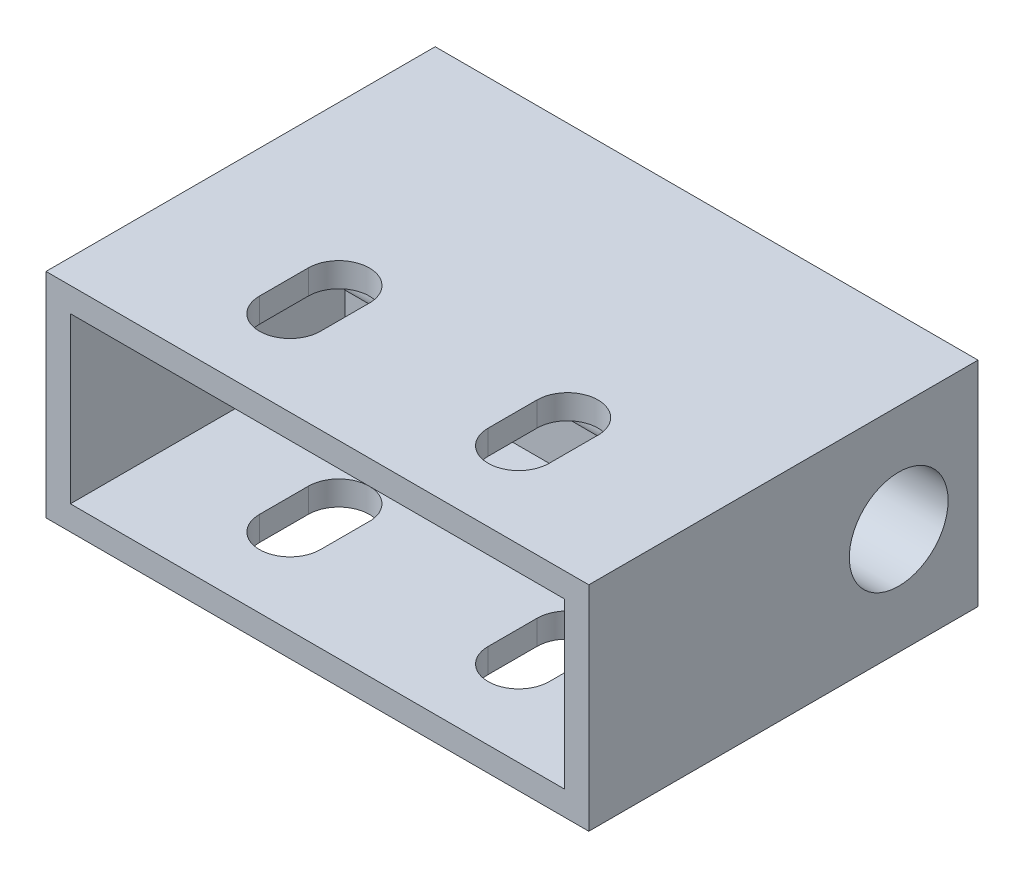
SolidWorks part; units mm, degrees
ref_plane "Front Plane" through (0, 0, 0) normal (0, 0, 1) x (1, 0, 0)
ref_plane "Top Plane" through (0, 0, 0) normal (0, 1, 0) x (1, 0, 0)
ref_plane "Right Plane" through (0, 0, 0) normal (1, 0, 0) x (0, 0, -1)
sketch "Sketch1" plane through (0, 0, 0) normal (0, 1, 0) x (1, 0, 0)
  line L1 (0, 0) -> (22.606, 0)
  line L2 (0, 0) -> (0, 16.2084)
  line L3 (0, 16.2084) -> (22.606, 16.2084)
  line L4 (22.606, 0) -> (22.606, 16.2084)
  dimension "D1" = 16.2084
  dimension "D2" = 22.606
extrude "Boss-Extrude1" add sketch "Sketch1" along normal blind 8.89
sketch "Sketch2" plane through (0, 0, 0) normal (0, 0, 1) x (1, 0, 0)
  line L0 (0, 8.89) -> (22.606, 8.89) construction
  line L1 (1.016, 7.874) -> (21.59, 7.874)
  line L2 (1.016, 7.874) -> (1.016, 1.016)
  line L3 (1.016, 1.016) -> (21.59, 1.016)
  line L4 (21.59, 7.874) -> (21.59, 1.016)
  line L5 (0, 8.89) -> (0, 0) construction
  dimension "D1" = 1.016
  dimension "D2" = 1.016
  dimension "D3" = 20.574
  dimension "D4" = 6.858
extrude "Cut-Extrude1" cut sketch "Sketch2" against normal blind 11.43
sketch "Sketch3" plane through (0, 8.89, 0) normal (0, 1, 0) x (1, 0, 0)
  line L0 (22.606, 0) -> (22.606, 16.2084) construction
  line L2 (0, 0) -> (22.606, 0) construction
  line L3 (5.334, 5.588) -> (7.874, 5.588)
  line L4 (5.334, 5.588) -> (5.334, 3.556)
  line L5 (5.334, 3.556) -> (7.874, 3.556)
  line L6 (7.874, 5.588) -> (7.874, 3.556)
  line L7 (14.859, 5.588) -> (17.399, 5.588)
  line L8 (14.859, 5.588) -> (14.859, 3.556)
  line L9 (14.859, 3.556) -> (17.399, 3.556)
  line L10 (17.399, 5.588) -> (17.399, 3.556)
  circle A0 centre (6.604, 3.556) radius 1.27
  circle A1 centre (16.129, 3.556) radius 1.27
  circle A2 centre (6.606, 5.588) radius 1.272
  circle A3 centre (16.131, 5.588) radius 1.272
  dimension "D1" = 9.525
  dimension "D2" = 6.477
  dimension "D3" = 3.556
  dimension "D4" = 2.032
  dimension "D5" = 2.032
sketch "Sketch5" plane through (22.606, 0, 0) normal (1, 0, 0) x (0, 0, -1)
  line L0 (0, 8.89) -> (16.2084, 8.89) construction
  line L1 (0, 8.89) -> (0, 0) construction
  circle A0 centre (12.9064, 4.445) radius 2.0574
  dimension "D1" = 4.445
  dimension "D2" = 12.9064
extrude "Cut-Extrude3" cut sketch "Sketch5" against normal blind 54.0265
extrude "Cut-Extrude4" cut sketch "Sketch3" against normal blind 22.7845 contours L5 A0 | A2 A0 L5 | A2 A0 L6 | A0 A2 | A2 L4 A0 | A0 A2 L3 | L3 A2 | A3 L8 A1 | A1 A3 | A1 A3 L7 | A3 A1 L9 | A3 A1 L10 | L9 A1 | L7 A3
